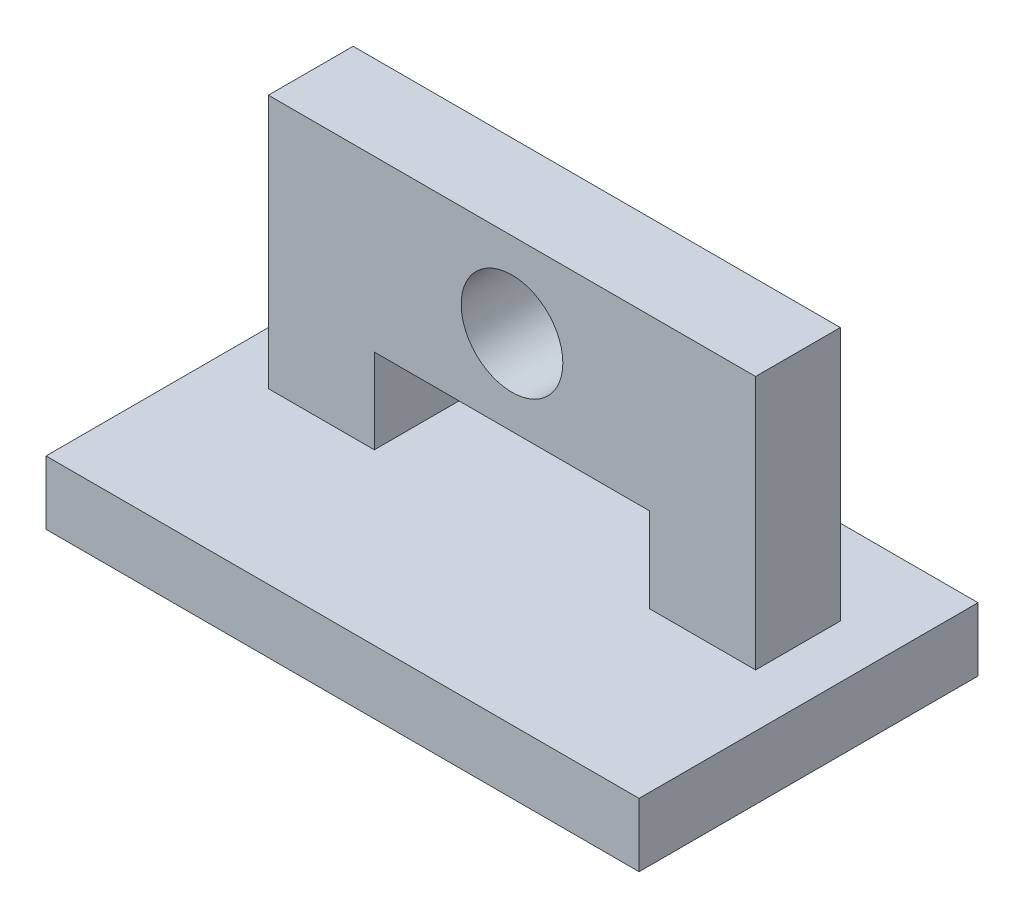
SolidWorks part; units mm, degrees
ref_plane "前视基准面" through (0, 0, 0) normal (0, 0, 1) x (1, 0, 0)
ref_plane "上视基准面" through (0, 0, 0) normal (0, 1, 0) x (1, 0, 0)
ref_plane "右视基准面" through (0, 0, 0) normal (1, 0, 0) x (0, 0, -1)
other "Configuration Table"
sketch "草图1" plane through (0, 0, 0) normal (0, 1, 0) x (1, 0, 0)
  line L1 (-70, -40) -> (70, -40)
  line L2 (-70, -40) -> (-70, 40)
  line L3 (-70, 40) -> (70, 40)
  line L4 (70, -40) -> (70, 40)
  line L5 (-70, -40) -> (70, 40) construction
  line L6 (-70, 40) -> (70, -40) construction
  point P0 (0, 0)
extrude "凸台-拉伸1" add sketch "草图1" against normal blind 15
sketch "草图2" plane through (0, 0, 0) normal (0, 0, 1) x (1, 0, 0)
  line L1 (-57.5, 0) -> (-32.5, 0)
  line L2 (-57.5, 0) -> (-57.5, 60)
  line L3 (-57.5, 60) -> (-32.5, 60)
  line L4 (-32.5, 0) -> (-32.5, 60)
  line L5 (-57.5, 0) -> (-32.5, 60) construction
  line L6 (-57.5, 60) -> (-32.5, 0) construction
  point P0 (-45, 30)
sketch "草图3" plane through (0, 0, 0) normal (0, 0, 1) x (1, 0, 0)
  line L1 (32.5, 0) -> (57.5, 0)
  line L2 (32.5, 0) -> (32.5, 60)
  line L3 (32.5, 60) -> (57.5, 60)
  line L4 (57.5, 0) -> (57.5, 60)
  line L5 (32.5, 0) -> (57.5, 60) construction
  line L6 (32.5, 60) -> (57.5, 0) construction
  point P0 (45, 30)
extrude "凸台-拉伸2" add sketch "草图2" against normal blind 20
extrude "凸台-拉伸3" add sketch "草图3" against normal blind 20
sketch "草图4" plane through (0, 0, 0) normal (0, 0, 1) x (1, 0, 0)
  line L0 (57.5, 60) -> (32.5, 60) construction
  line L1 (-35, 20) -> (35, 20)
  line L2 (-35, 20) -> (-35, 60)
  line L3 (-35, 60) -> (35, 60)
  line L4 (35, 20) -> (35, 60)
  line L5 (-35, 20) -> (35, 60) construction
  line L6 (-35, 60) -> (35, 20) construction
  point P0 (0, 40)
extrude "凸台-拉伸4" add sketch "草图4" against normal blind 20
sketch "草图5" plane through (0, 0, 0) normal (0, 0, 1) x (1, 0, 0)
  circle A0 centre (0, 40) radius 12
extrude "切除-拉伸1" cut sketch "草图5" against normal blind 20
